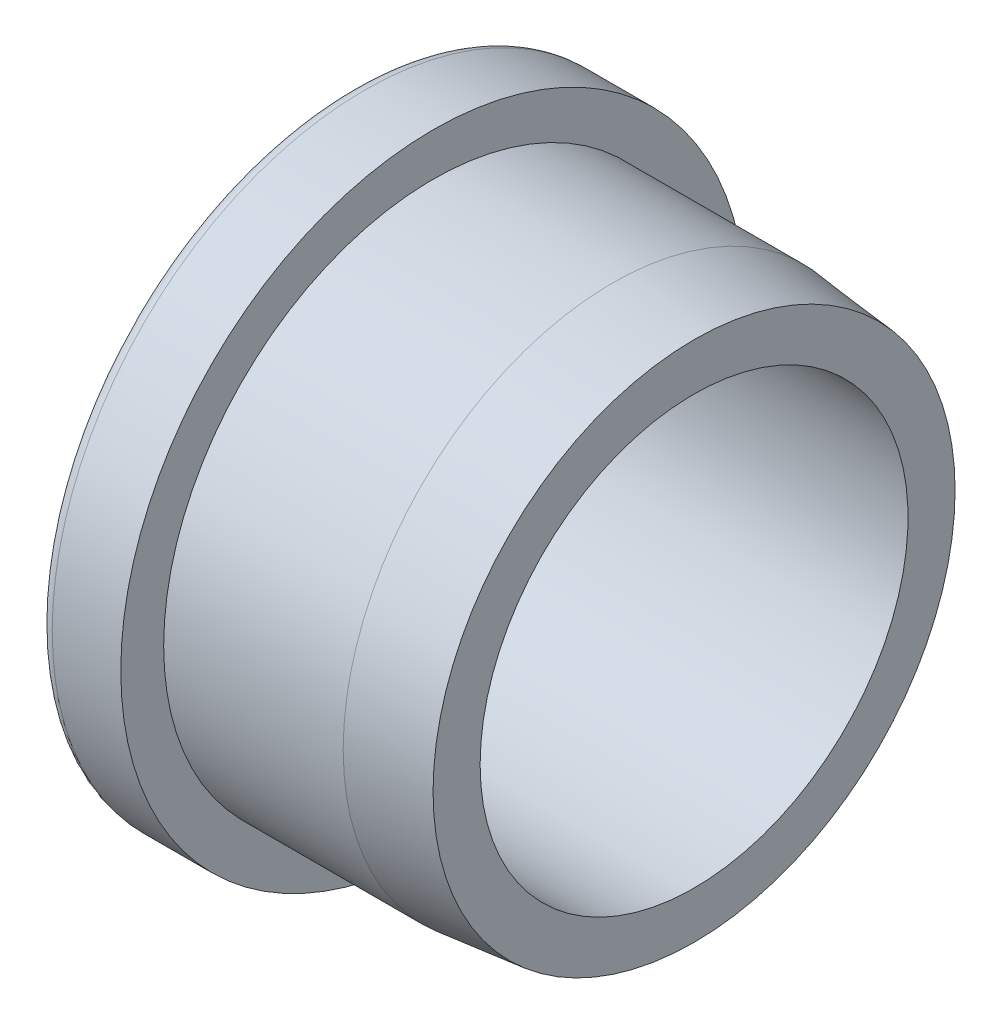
SolidWorks part; units mm, degrees
ref_plane "Plane1" through (0, 0, 0) normal (0, 0, 1) x (1, 0, 0)
ref_plane "Plane2" through (0, 0, 0) normal (0, 1, 0) x (1, 0, 0)
ref_plane "Plane3" through (0, 0, 0) normal (1, 0, 0) x (0, 0, -1)
sketch "Esquisse1" plane through (0, 0, 0) normal (0, 0, 1) x (1, 0, 0)
  line L0 (0, 5) -> (8, 5)
  line L1 (6.0976, 6.2978) -> (8, 6.1)
  line L2 (0, 5) -> (0, 7.3)
  line L3 (0, 7.3) -> (1.9024, 7.3)
  line L4 (8, 6.1) -> (8, 5)
  line L5 (-1.1, 0) -> (9.4, 0) construction
  line L6 (1.9024, 7.3) -> (1.9024, 6.2978)
  line L7 (1.9024, 6.2978) -> (6.0976, 6.2978)
revolve "Base-Révolution" add sketch "Esquisse1" angle 360 about L5
fillet "Congé2" radius 0.3
